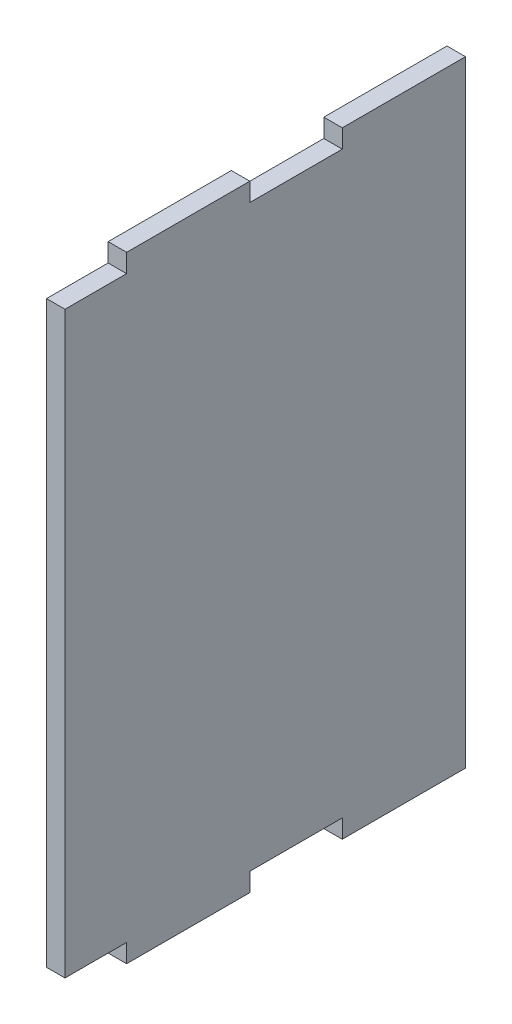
SolidWorks part; units mm, degrees
ref_plane "Front Plane" through (0, 0, 0) normal (0, 0, 1) x (1, 0, 0)
ref_plane "Top Plane" through (0, 0, 0) normal (0, 1, 0) x (1, 0, 0)
ref_plane "Right Plane" through (0, 0, 0) normal (1, 0, 0) x (0, 0, -1)
sketch "草图3" plane through (0, 0, 0) normal (1, 0, 0) x (0, 0, -1)
  line L0 (-62.0734, 59.2776) -> (-62.0734, -40.7224)
  line L1 (-62.0734, -40.7224) -> (2.9266, -40.7224)
  line L2 (2.9266, -40.7224) -> (2.9266, 59.2776)
  line L3 (2.9266, 59.2776) -> (-62.0734, 59.2776)
  dimension "D1" = 100
  dimension "D2" = 65
extrude "凸台-拉伸2" add sketch "草图3" along normal blind 3
sketch "草图4" plane through (3, 0, 0) normal (1, 0, 0) x (0, 0, -1)
  line L0 (-62.0734, -40.7224) -> (-62.0734, -37.7224)
  line L1 (-62.0734, 59.2776) -> (-62.0734, -40.7224) construction
  line L2 (-62.0734, -37.7224) -> (-52.0734, -37.7224)
  line L3 (-52.0734, -37.7224) -> (-52.0734, -40.7224)
  line L4 (-62.0734, -40.7224) -> (2.9266, -40.7224) construction
  line L5 (-52.0734, -40.7224) -> (-62.0734, -40.7224)
  line L6 (-32.0734, -37.7224) -> (-32.0734, -40.7224)
  line L7 (-32.0734, -40.7224) -> (-17.0734, -40.7224)
  line L8 (-17.0734, -40.7224) -> (-17.0734, -37.7224)
  line L9 (-17.0734, -37.7224) -> (-32.0734, -37.7224)
  line L10 (-62.0734, 9.2776) -> (2.9266, 9.2776) construction
  line L11 (2.9266, -40.7224) -> (2.9266, 59.2776) construction
  line L12 (-17.0734, 56.2776) -> (-32.0734, 56.2776)
  line L13 (-17.0734, 59.2776) -> (-17.0734, 56.2776)
  line L14 (-32.0734, 59.2776) -> (-17.0734, 59.2776)
  line L15 (-32.0734, 56.2776) -> (-32.0734, 59.2776)
  line L16 (-52.0734, 59.2776) -> (-62.0734, 59.2776)
  line L17 (-52.0734, 56.2776) -> (-52.0734, 59.2776)
  line L18 (-62.0734, 56.2776) -> (-52.0734, 56.2776)
  line L19 (-62.0734, 59.2776) -> (-62.0734, 56.2776)
  dimension "D1" = 10
  dimension "D2" = 3
  dimension "D3" = 3
  dimension "D4" = 15
  dimension "D5" = 20
extrude "切除-拉伸1" cut sketch "草图4" against normal blind 3
